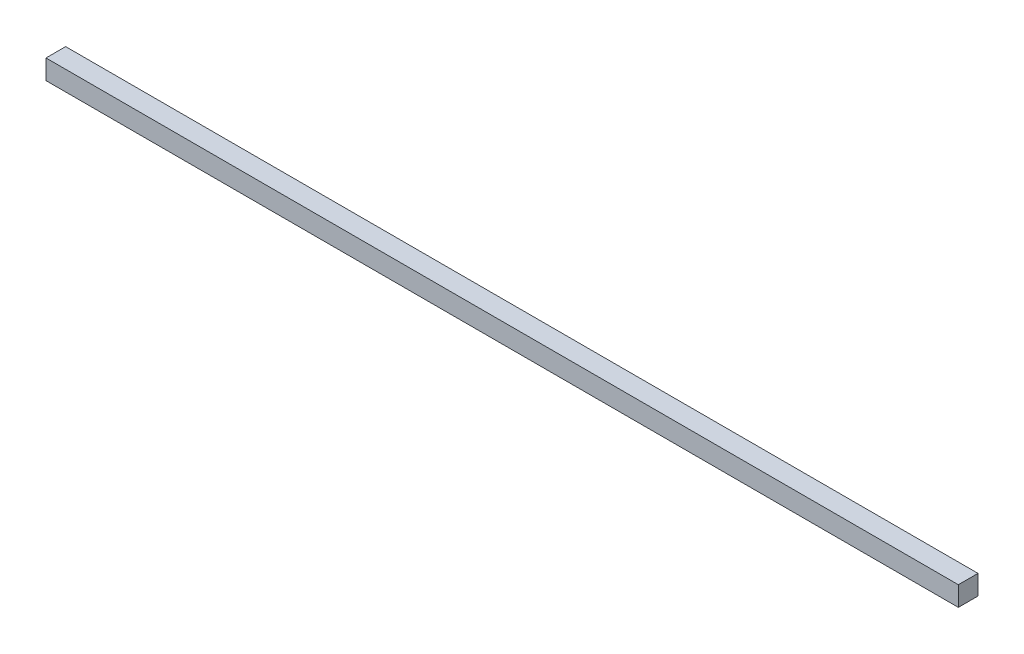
SolidWorks part; units mm, degrees
ref_plane "Спереди" through (0, 0, 0) normal (0, 0, 1) x (1, 0, 0)
ref_plane "Сверху" through (0, 0, 0) normal (0, 1, 0) x (1, 0, 0)
ref_plane "Справа" through (0, 0, 0) normal (1, 0, 0) x (0, 0, -1)
sketch "Эскиз1" plane through (0, 0, 0) normal (1, 0, 0) x (0, 0, -1)
  line L1 (-39.875, 12.25) -> (-25.875, 12.25)
  line L2 (-39.875, 12.25) -> (-39.875, -1.75)
  line L3 (-39.875, -1.75) -> (-25.875, -1.75)
  line L4 (-25.875, 12.25) -> (-25.875, -1.75)
  dimension "D1" = 14
  dimension "D2" = 14
extrude "Бобышка-Вытянуть1" add sketch "Эскиз1" along normal blind 650
